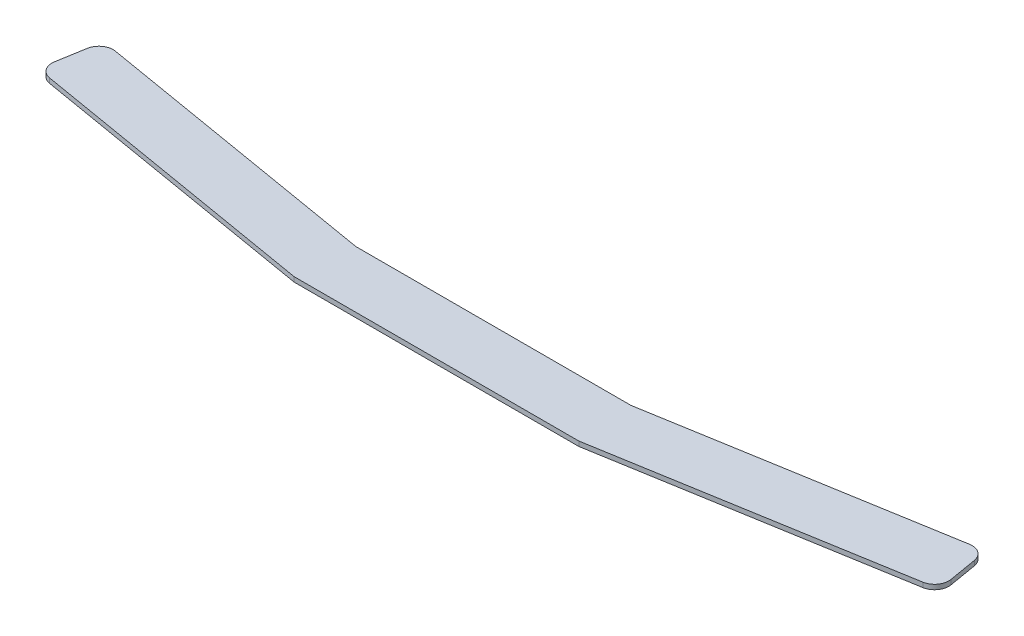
SolidWorks part; units mm, degrees
ref_plane "Спереди" through (0, 0, 0) normal (0, 0, 1) x (1, 0, 0)
ref_plane "Сверху" through (0, 0, 0) normal (0, 1, 0) x (1, 0, 0)
ref_plane "Справа" through (0, 0, 0) normal (1, 0, 0) x (0, 0, -1)
sketch "Эскиз1" plane through (0, 0, 0) normal (0, 1, 0) x (1, 0, 0)
  line L0 (0, 15) -> (0, 0) construction
  line L1 (-30, 0) -> (30, 0)
  line L2 (30, 0) -> (92.0421, 10.4994)
  line L3 (28.9918, 12) -> (90.0398, 22.3312)
  line L4 (94.4994, 13.9579) -> (93.4983, 19.8738)
  line L5 (-28.9918, 12) -> (28.9918, 12)
  line L6 (-94.4994, 13.9579) -> (-93.4983, 19.8738)
  line L7 (-28.9918, 12) -> (-90.0398, 22.3312)
  line L8 (-30, 0) -> (-92.0421, 10.4994)
  arc A0 (93.4983, 19.8738) -> (90.0398, 22.3312) centre (90.5403, 19.3733) ccw
  arc A1 (92.0421, 10.4994) -> (94.4994, 13.9579) centre (91.5415, 13.4574) ccw
  arc A2 (-92.0421, 10.4994) -> (-94.4994, 13.9579) centre (-91.5415, 13.4574) cw
  arc A3 (-93.4983, 19.8738) -> (-90.0398, 22.3312) centre (-90.5403, 19.3733) cw
  point P13 (95, 11)
  dimension "D2" = 3
  dimension "D3" = 3
  dimension "D1" = 12
extrude "Бобышка-Вытянуть1" add sketch "Эскиз1" along normal blind 1
